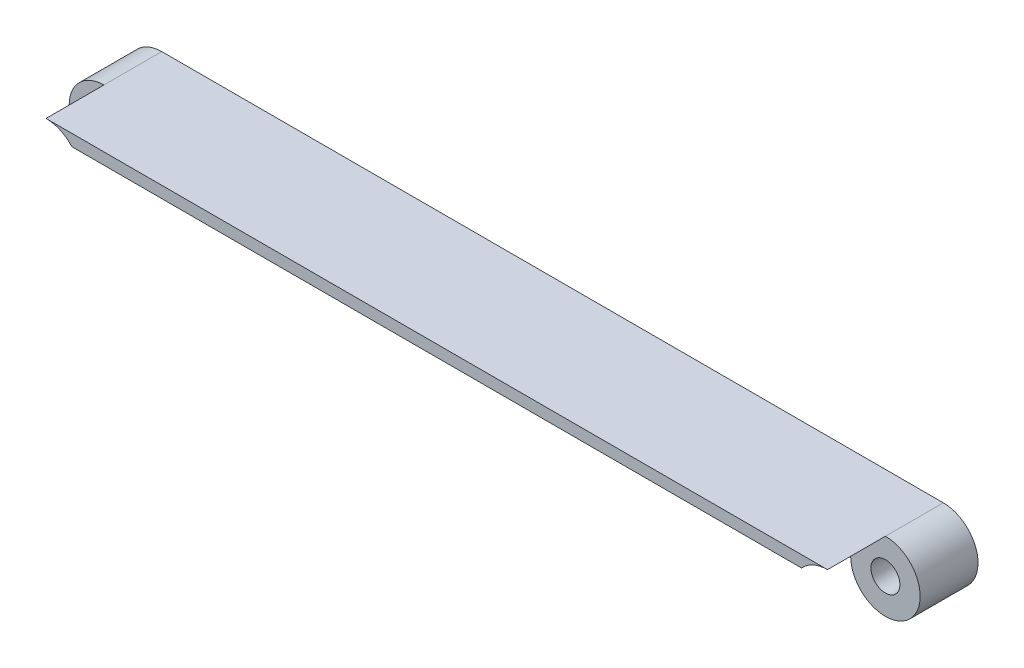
SolidWorks part; units mm, degrees
ref_plane "Plan de face" through (0, 0, 0) normal (0, 0, 1) x (1, 0, 0)
ref_plane "Plan de dessus" through (0, 0, 0) normal (0, 1, 0) x (1, 0, 0)
ref_plane "Plan de droite" through (0, 0, 0) normal (1, 0, 0) x (0, 0, -1)
sketch "Esquisse1" plane through (0, 0, 0) normal (0, 0, 1) x (1, 0, 0)
  line L0 (-135, 6) -> (0, 6)
  line L1 (-130.5279, 4) -> (-4.4721, 4)
  arc A0 (-4.4721, 4) -> (0, 6) centre (0, 0) ccw
  arc A1 (-135, 6) -> (-130.5279, 4) centre (-135, 0) ccw
  circle A2 centre (-135, 0) radius 2.5
  circle A3 centre (0, 0) radius 2.5
extrude "Boss.-Extru.1" add sketch "Esquisse1" along normal blind 20
sketch "Esquisse2" plane through (0, 0, 20) normal (0, 0, 1) x (1, 0, 0)
  circle A0 centre (0, 0) radius 6
  circle A1 centre (-135, 0) radius 6
  dimension "D1" = 12
  dimension "D2" = 12
extrude "Enlèv. mat.-Extru.1" cut sketch "Esquisse2" against normal blind 10
equation "\"D5@Esquisse1\"=\"D4@Esquisse1\""
